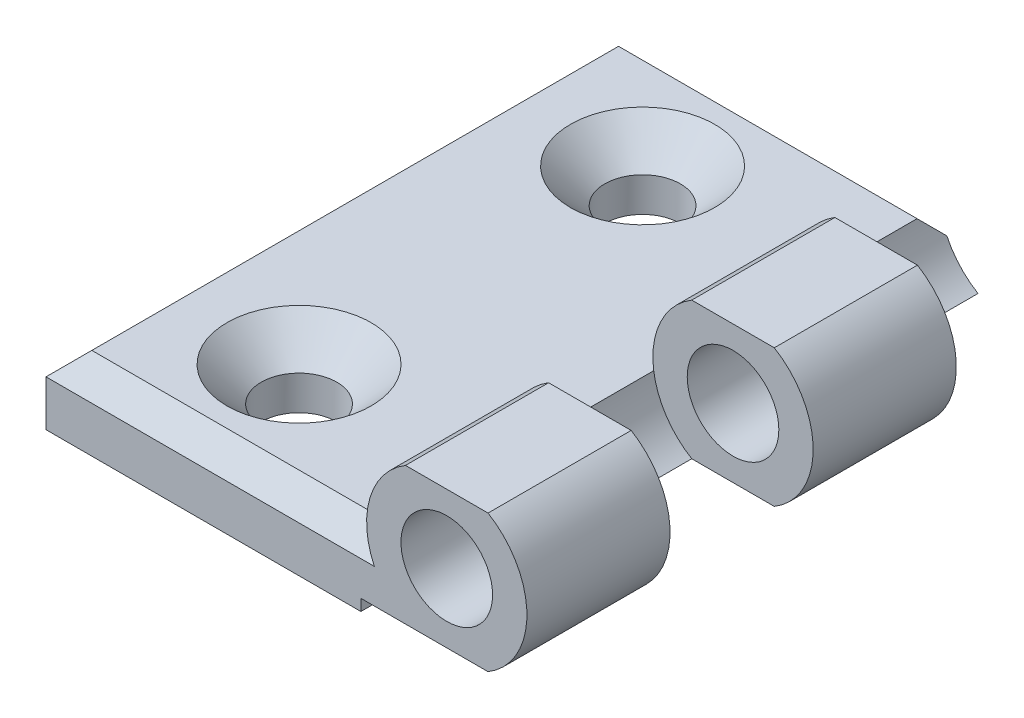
SolidWorks part; units mm, degrees
ref_plane "Ön Düzlem" through (0, 0, 0) normal (0, 0, 1) x (1, 0, 0)
ref_plane "Üst Düzlem" through (0, 0, 0) normal (0, 1, 0) x (1, 0, 0)
ref_plane "Sağ Düzlem" through (0, 0, 0) normal (1, 0, 0) x (0, 0, -1)
sketch "Çizim1" plane through (0, 0, 0) normal (0, 0, 1) x (1, 0, 0)
  line L0 (-7.5, -7) -> (-7.5, -6)
  line L1 (-6.9282, -1) -> (-35, -1)
  line L2 (-7.5, -7) -> (-35, -7)
  line L3 (-7.5, -6) -> (3.6056, -6)
  line L4 (0, 0) -> (0, 7) construction
  line L5 (-35, -7) -> (-35, -1)
  line L6 (3.6056, 6) -> (-3.6056, 6)
  arc A0 (3.6056, -6) -> (3.6056, 6) centre (0, 0) ccw
  circle A1 centre (0, 0) radius 4
  arc A2 (-3.6056, 6) -> (-6.9282, -1) centre (0, 0) ccw
  dimension "D1" = 14
  dimension "D2" = 8
  dimension "D3" = 35
  dimension "D4" = 6
  dimension "D5" = 6.9282
  dimension "D6" = 1
  dimension "D7" = 7.5
  dimension "D9" = 7
  dimension "D10" = 7.2111
extrude "Yükseklik-Ekstrüzyon1" add sketch "Çizim1" along normal mid plane 50
sketch "Çizim2" plane through (0, 6, 0) normal (0, 1, 0) x (1, 0, 0)
  line L0 (0, 25) -> (0, -25) construction
  line L1 (3.6056, 25) -> (-3.6056, 25) construction
  line L2 (3.6056, -25) -> (-3.6056, -25) construction
hole_wizard "M6 Düz Havşa Başlı Vida İçin Havşa1" positions "Çizim3" profile "Çizim4" countersink size "M6" standard "ISO"
sketch "Çizim3" plane through (0, -1, 0) normal (0, 1, 0) x (1, 0, 0)
  line L0 (0, 25) -> (0, -25) construction
  line L1 (-6.9282, -25) -> (-35, -25) construction
  point P0 (-22.9, -15)
  point P7 (-22.9, 15)
  dimension "D1" = 22.9
  dimension "D2" = 10
  dimension "D3" = 30
  dimension "D4" = 22.9
sketch "Çizim4" plane through (-22.9, -1, 15) normal (1, 0, 0) x (0, 0, 1)
  line L0 (0, 0) -> (0, 6)
  line L1 (0, 6) -> (3.3, 6)
  line L2 (3.3, 6) -> (3.3, 3)
  line L3 (3.3, 3) -> (6.3, 0)
  line L5 (6.3, 0) -> (0, 0)
  line L6 (-3.3, 3) -> (-6.3, 0) construction
  line L11 (0, -6.35) -> (0, 107.95) construction
  dimension "Thru Hole Dia." = 6.6
  dimension "Thru Hole Depth" = 6
  dimension "Near C'Sink Dia." = 12.6
  dimension "Near C'Sink Angle" = 90
chamfer "Pah1" distance 2 angle 45 3 edges at (-20.9641, -1, -25) (-35, -1, 0) (-20.9641, -1, 25)
ref_plane "Düzlem1" through (0, 0, 12.5) normal (0, 0, 1) x (1, 0, 0)
sketch "Çizim5" plane through (0, 0, 12.5) normal (0, 0, 1) x (1, 0, 0)
  circle A0 centre (0, 0) radius 7
extrude "Kes-Ekstrüzyon1" cut sketch "Çizim5" against normal blind 12.5
sketch "Çizim7" plane through (0, 0, -25) normal (0, 0, -1) x (-1, 0, 0)
  circle A0 centre (0, 0) radius 7
extrude "Kes-Ekstrüzyon2" cut sketch "Çizim7" against normal blind 12.5
